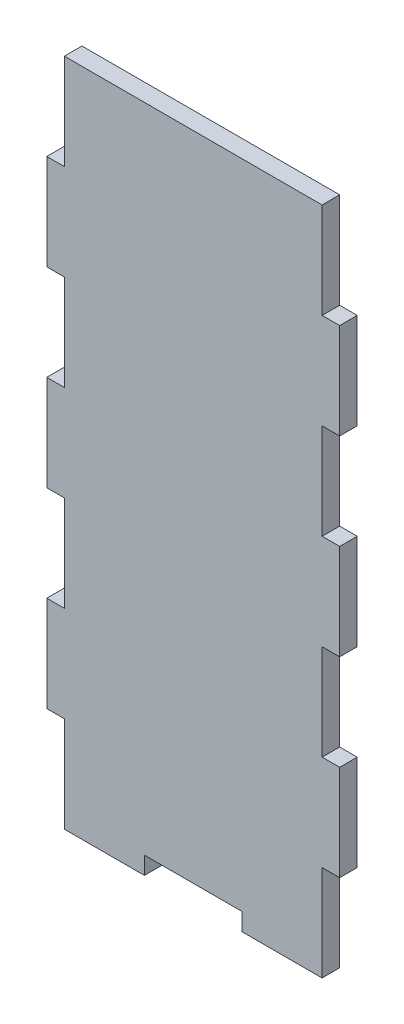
SolidWorks part; units mm, degrees
ref_plane "Front Plane" through (0, 0, 0) normal (0, 0, 1) x (1, 0, 0)
ref_plane "Top Plane" through (0, 0, 0) normal (0, 1, 0) x (1, 0, 0)
ref_plane "Right Plane" through (0, 0, 0) normal (1, 0, 0) x (0, 0, -1)
sketch "Sketch1" plane through (0, 0, 0) normal (0, 0, 1) x (1, 0, 0)
  line L1 (-44.45, -101.6) -> (44.45, -101.6)
  line L2 (-44.45, -101.6) -> (-44.45, 101.6)
  line L3 (-44.45, 101.6) -> (44.45, 101.6)
  line L4 (44.45, -101.6) -> (44.45, 101.6)
  line L5 (-44.45, -101.6) -> (44.45, 101.6) construction
  line L6 (-44.45, 101.6) -> (44.45, -101.6) construction
  point P0 (0, 0)
  dimension "D1" = 203.2
  dimension "D2" = 88.9
extrude "Boss-Extrude1" add sketch "Sketch1" along normal blind 5.334
sketch "Sketch3" plane through (0, 0, 0) normal (0, 0, -1) x (-1, 0, 0)
  line L0 (44.45, -101.6) -> (-44.45, -101.6) construction
  line L1 (-14.8167, -101.6) -> (14.8167, -101.6)
  line L2 (-14.8167, -101.6) -> (-14.8167, -96.266)
  line L3 (-14.8167, -96.266) -> (14.8167, -96.266)
  line L4 (14.8167, -101.6) -> (14.8167, -96.266)
  line L5 (-14.8167, -96.266) -> (-44.45, -96.266) construction
  line L6 (-44.45, -101.6) -> (-44.45, 101.6) construction
  line L7 (14.8167, -96.266) -> (44.45, -96.266) construction
  line L8 (44.45, 101.6) -> (44.45, -101.6) construction
extrude "Cut-Extrude2" cut sketch "Sketch3" against normal through all
other "Cavity2"
other "boxSide<1>@MinSpecRobot1"
other "boxSide<2>@MinSpecRobot1"
equation "\"D1@Boss-Extrude1\" = \"material\""
equation "\"material\"= \"MDF@Platform.assembly\""
